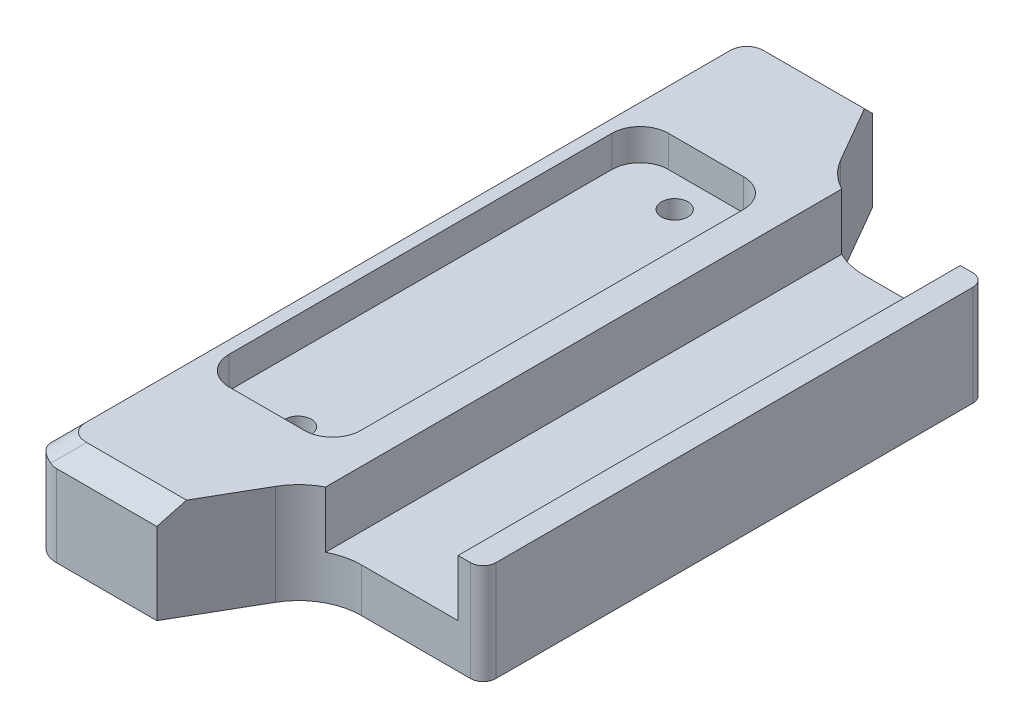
SolidWorks part; units mm, degrees
ref_plane "Plan1" through (0, 0, 0) normal (0, 0, 1) x (1, 0, 0)
ref_plane "Plan2" through (0, 0, 0) normal (0, 1, 0) x (1, 0, 0)
ref_plane "Plan3" through (0, 0, 0) normal (1, 0, 0) x (0, 0, -1)
sketch "Esquisse1" plane through (0, 0, 0) normal (0, 0, 1) x (1, 0, 0)
  line L1 (0, 0) -> (55, 0)
  line L2 (0, 0) -> (0, 16)
  line L3 (0, 16) -> (55, 16)
  line L4 (55, 0) -> (55, 16)
  dimension "D1" = 55
  dimension "D2" = 16
extrude "Base-Extrusion" add sketch "Esquisse1" along normal mid plane 114
chamfer "Chanfrein2" distance 3 angle 45 3 edges at (27.5, 16, 57) (27.5, 16, -57) (0, 16, 0)
sketch "Esquisse15"
  line L0 (25, 0) -> (-67, 0) construction
  line L1 (-55, 40) -> (-29.815, 40)
  line L2 (-55, 54) -> (-55, -54) construction
  line L3 (-29.815, 40) -> (-20, 57)
  line L4 (-55, 57) -> (0, 57) construction
  line L5 (-20, 57) -> (-55, 57)
  line L6 (-55, 57) -> (-55, 40)
  line L7 (-55, -57) -> (-55, -40)
  line L8 (-20, -57) -> (-55, -57)
  line L9 (-29.815, -40) -> (-20, -57)
  line L10 (-55, -40) -> (-29.815, -40)
  line L11 (0, 57) -> (0, -57) construction
fillet "Congé4" radius 4 2 edges at (0, 6.5, 57) (0, 6.5, -57)
fillet "Congé6" radius 4 4 edges at (2.0858, 15.0858, -54.9142) (2.0858, 15.0858, 54.9142) (0.3045, 13.3045, -54.5307) (2.4693, 13.3045, 56.6955)
extrude "Enlèv. mat.-Extru.7" cut sketch "Esquisse15" against normal through all
fillet "Congé9" radius 10 2 edges at (29.815, 8, -40) (29.815, 8, 40)
sketch "Esquisse10" plane through (0, 16, 0) normal (0, 1, 0) x (-1, 0, 0)
  line L1 (-26, 35) -> (-5, 35)
  line L2 (-26, 35) -> (-26, -35)
  line L3 (-26, -35) -> (-5, -35)
  line L4 (-5, 35) -> (-5, -35)
  line L5 (0, 53) -> (0, -53) construction
  line L6 (-38, 0) -> (15, 0) construction
  dimension "D1" = 70
  dimension "D2" = 21
  dimension "D4" = 5
extrude "Enlèv. mat.-Extru.6" cut sketch "Esquisse10" against normal blind 5
fillet "Congé8" radius 4.5 4 edges at (26, 13.5, -35) (26, 13.5, 35) (5, 13.5, 35) (5, 13.5, -35)
hole_wizard "Chambrage pour vis à tête ronde bombée M51" positions "Esquisse12" profile "Esquisse11" counterbore size "M5" standard "Ansi Métrique"
sketch "Esquisse12" plane through (0, 0, 0) normal (0, -1, 0) x (1, 0, 0)
  line L0 (0, 53) -> (0, -53) construction
  line L1 (4, -57) -> (20, -57) construction
  point P0 (15.5, -30)
  dimension "D1" = 15.5
  dimension "D2" = 27
sketch "Esquisse11" plane through (15.5, 0, -30) normal (1, 0, 0) x (0, 0, -1)
  line L0 (0, 0) -> (0, 11)
  line L1 (0, 11) -> (2.1, 11)
  line L3 (2.1, 11) -> (2.1, 5)
  line L4 (2.1, 5) -> (3.6, 5)
  line L5 (3.6, 5) -> (3.6, 0)
  line L7 (3.6, 0) -> (0, 0)
  line L11 (0, -6.35) -> (0, 107.95) construction
  dimension "Diamètre du perçage jusqu'au prochain" = 4.2
  dimension "Profondeur du perçage jusqu'au prochain" = 11
  dimension "Diamètre du chambrage" = 7.2
  dimension "Profondeur du chambrage" = 5
hole_wizard "Chambrage pour vis à tête ronde bombée M41" positions "Esquisse14" profile "Esquisse13" counterbore size "M4" standard "Ansi Métrique"
sketch "Esquisse14" plane through (0, 0, 0) normal (0, -1, 0) x (1, 0, 0)
  line L0 (0, 53) -> (0, -53) construction
  line L1 (4, 57) -> (20, 57) construction
  point P0 (15.5, 30)
  dimension "D1" = 15.5
  dimension "D2" = 27
sketch "Esquisse13" plane through (15.5, 0, 30) normal (1, 0, 0) x (0, 0, -1)
  line L0 (0, 0) -> (0, 11)
  line L1 (0, 11) -> (2.1, 11)
  line L3 (2.1, 11) -> (2.1, 5)
  line L4 (2.1, 5) -> (3.6, 5)
  line L5 (3.6, 5) -> (3.6, 0)
  line L7 (3.6, 0) -> (0, 0)
  line L11 (0, -6.35) -> (0, 107.95) construction
  dimension "Diamètre du perçage jusqu'au prochain" = 4.2
  dimension "Profondeur du perçage jusqu'au prochain" = 11
  dimension "Diamètre du chambrage" = 7.2
  dimension "Profondeur du chambrage" = 5
sketch "Esquisse16" plane through (0, 0, 0) normal (0, 0, 1) x (1, 0, 0)
  line L0 (55, 16) -> (35.5885, 16) construction
  line L1 (51, 16) -> (31, 16)
  line L2 (51, 16) -> (51, 7)
  line L3 (51, 7) -> (31, 7)
  line L4 (31, 16) -> (31, 7)
  line L5 (55, 0) -> (55, 16) construction
  dimension "D1" = 20
  dimension "D2" = 4
  dimension "D3" = 9
extrude "Enlèv. mat.-Extru.8" cut sketch "Esquisse16" against normal through all and the other way through all
fillet "Congé10" radius 2 1 edges at (55, 8, -40)
fillet "Congé11" radius 2 1 edges at (55, 8, 40)
